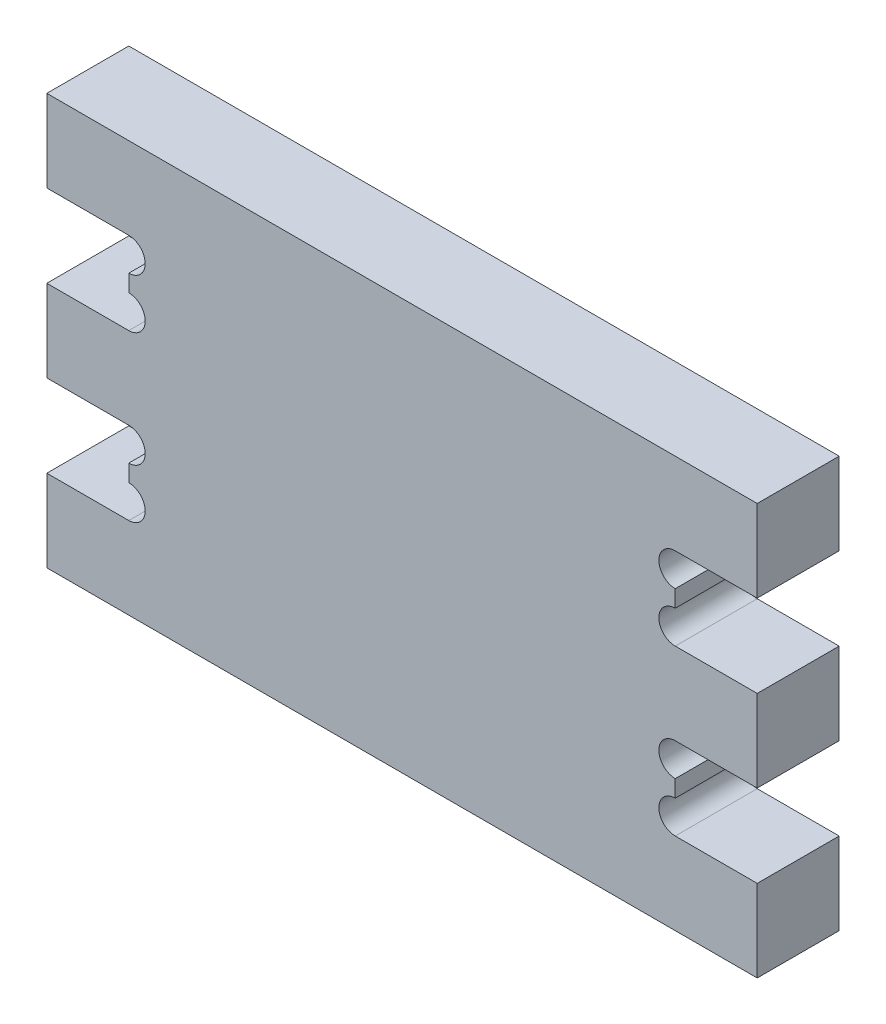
SolidWorks part; units mm, degrees
ref_plane "Ebene vorne" through (0, 0, 0) normal (0, 0, 1) x (1, 0, 0)
ref_plane "Ebene oben" through (0, 0, 0) normal (0, 1, 0) x (1, 0, 0)
ref_plane "Ebene rechts" through (0, 0, 0) normal (1, 0, 0) x (0, 0, -1)
sketch "Skizze1" plane through (0, 0, 0) normal (0, 0, 1) x (1, 0, 0)
  line L0 (15, 82.6) -> (115, 82.6)
  line L1 (115, 7.4) -> (15, 7.4)
  line L2 (15, 82.6) -> (0, 82.6)
  line L5 (0, 82.6) -> (0, 67.6)
  line L6 (0, 67.6) -> (15, 67.6)
  line L7 (15, 61.6) -> (15, 58.5)
  line L8 (15, 52.5) -> (0, 52.5)
  line L9 (0, 52.5) -> (0, 37.5)
  line L10 (0, 37.5) -> (15, 37.5)
  line L11 (15, 31.5) -> (15, 28.4)
  line L13 (0, 22.4) -> (0, 7.4)
  line L14 (15, 22.4) -> (0, 22.4)
  line L15 (0, 7.4) -> (15, 7.4)
  line L17 (115, 82.6) -> (130, 82.6)
  line L18 (130, 67.6) -> (115, 67.6)
  line L19 (115, 61.6) -> (115, 58.5)
  line L20 (115, 52.5) -> (130, 52.5)
  line L21 (130, 52.5) -> (130, 37.5)
  line L22 (130, 37.5) -> (115, 37.5)
  line L23 (115, 31.5) -> (115, 28.4)
  line L24 (130, 82.6) -> (130, 67.6)
  line L25 (115, 22.4) -> (130, 22.4)
  line L26 (130, 7.4) -> (115, 7.4)
  line L27 (130, 22.4) -> (130, 7.4)
  arc A1 (15, 67.6) -> (15, 61.6) centre (15, 64.6) cw
  arc A2 (15, 58.5) -> (15, 52.5) centre (15, 55.5) cw
  arc A3 (15, 37.5) -> (15, 31.5) centre (15, 34.5) cw
  arc A4 (15, 28.4) -> (15, 22.4) centre (15, 25.4) cw
  arc A7 (115, 22.4) -> (115, 28.4) centre (115, 25.4) cw
  arc A8 (115, 31.5) -> (115, 37.5) centre (115, 34.5) cw
  arc A9 (115, 52.5) -> (115, 58.5) centre (115, 55.5) cw
  arc A10 (115, 61.6) -> (115, 67.6) centre (115, 64.6) cw
  dimension "D13" = 15
  dimension "D14" = 130
  dimension "D15" = 3.1
  dimension "D16" = 3.1
  dimension "D17" = 3.1
  dimension "D18" = 3.1
  dimension "D3" = 15
  dimension "D4" = 15
  dimension "D5" = 15
  dimension "D6" = 15
  dimension "D7" = 15.1
  dimension "D8" = 15.1
  dimension "D9" = 15
  dimension "D10" = 15
  dimension "D24" = 6
  dimension "D26" = 6
extrude "outline" add sketch "Skizze1" along normal blind 15
